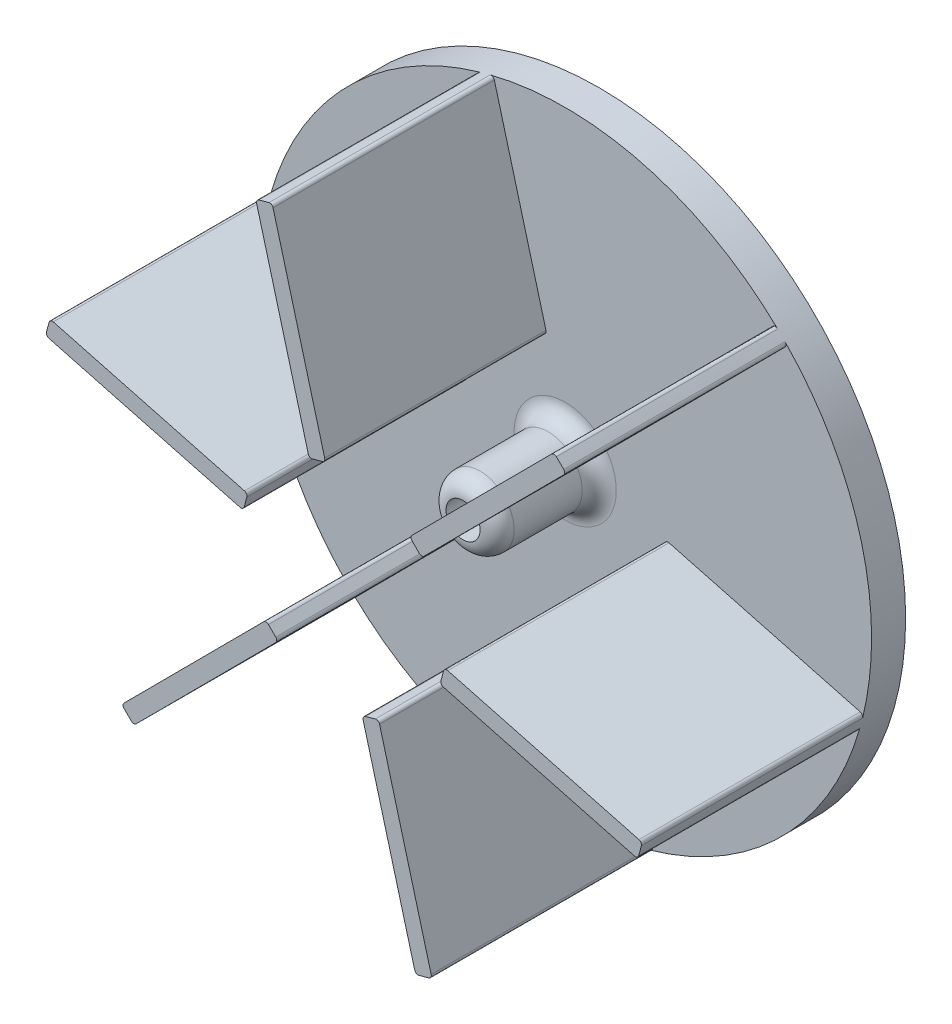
SolidWorks part; units mm, degrees
ref_plane "Front Plane" through (0, 0, 0) normal (0, 0, 1) x (1, 0, 0)
ref_plane "Top Plane" through (0, 0, 0) normal (0, 1, 0) x (1, 0, 0)
ref_plane "Right Plane" through (0, 0, 0) normal (1, 0, 0) x (0, 0, -1)
sketch "Sketch2" plane through (0, 0, 0) normal (0, 0, 1) x (1, 0, 0)
  circle A0 centre (0, 0) radius 18
  circle A1 centre (0, 0) radius 1
  dimension "D1" = 36
  dimension "D2" = 2
extrude "Boss-Extrude1" add sketch "Sketch2" against normal blind 2
sketch "Sketch5" plane through (0, 0, 0) normal (0, 0, 1) x (1, 0, 0)
  circle A0 centre (0, 0) radius 1
  circle A1 centre (0, 0) radius 2
  dimension "D1" = 4
  dimension "D2" = 2
extrude "Boss-Extrude3" add sketch "Sketch5" along normal blind 6
fillet "Fillet6" radius 1 2 edges at (2, 0, 6) (2, 0, 0)
sketch "Sketch6" plane through (0, 0, 0) normal (0, 0, 1) x (1, 0, 0)
  line L0 (0, 0) -> (11.6116, 11.6627) construction
  line L1 (4.5729, 3.8844) -> (13.0494, 12.3981)
  line L2 (3.8643, 4.5899) -> (12.3407, 13.1037)
  line L3 (3.8643, 4.5899) -> (4.5729, 3.8844)
  circle A0 centre (0, 0) radius 6 construction
  circle A2 centre (0, 0) radius 18 construction
  arc A3 (13.0494, 12.3981) -> (12.3407, 13.1037) centre (0, 0) ccw
  dimension "D1" = 0.5
  dimension "D2" = 0.5
extrude "Boss-Extrude4" add sketch "Sketch6" along normal blind 13
fillet "Fillet7" radius 0.2 4 edges at (3.8643, 4.5899, 6.5) (4.5729, 3.8844, 6.5) (13.0494, 12.3981, 6.5) (12.3407, 13.1037, 6.5)
pattern_circular "CirPattern2" count 6 over 360 about axis through (0, 0, 0) along (0, 0, 1) of "Boss-Extrude4", "Fillet7"
